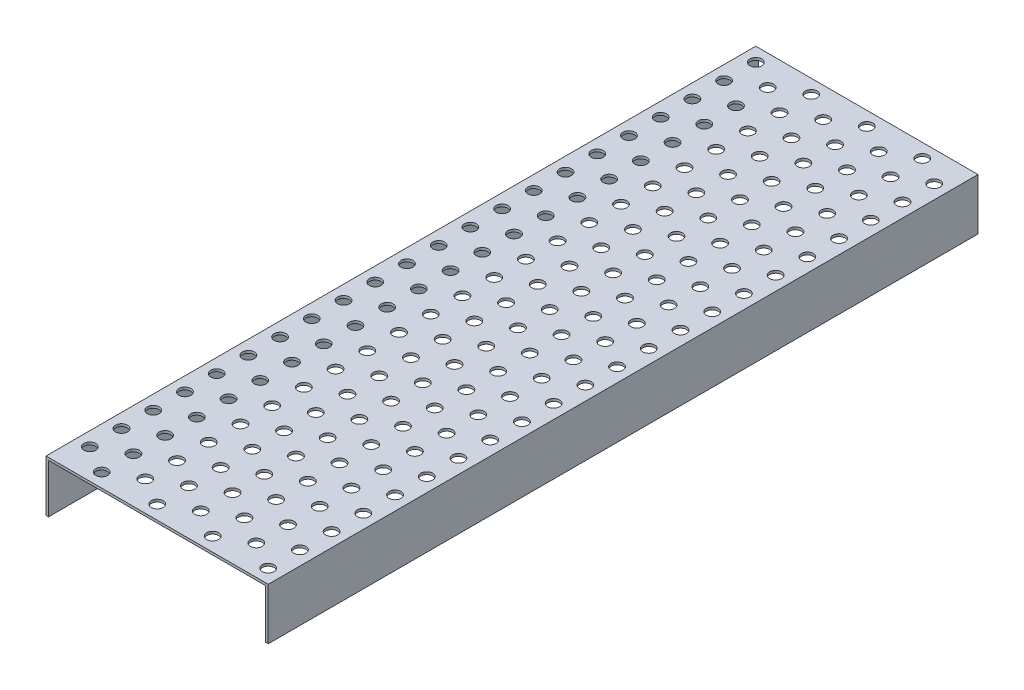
SolidWorks part; units mm, degrees
ref_plane "Alzado" through (0, 0, 0) normal (0, 0, 1) x (1, 0, 0)
ref_plane "Planta" through (0, 0, 0) normal (0, 1, 0) x (1, 0, 0)
ref_plane "Vista lateral" through (0, 0, 0) normal (1, 0, 0) x (0, 0, -1)
sketch "Croquis2" plane through (0, 0, 0) normal (0, 0, 1) x (1, 0, 0)
  line L0 (0, 0) -> (0, 41.275)
  line L1 (0, 41.275) -> (178, 41.275)
  line L2 (0, 0) -> (2, 0)
  line L3 (2, 0) -> (2, 39.275)
  line L4 (178, 41.275) -> (178, 0)
  line L5 (178, 0) -> (176, 0)
  line L6 (176, 0) -> (176, 39.275)
  line L7 (2, 39.275) -> (176, 39.275)
  dimension "D1" = 41.275
  dimension "D2" = 178
  dimension "D3" = 2
  dimension "D4" = 2
  dimension "D5" = 39.275
  dimension "D6" = 39.275
extrude "Saliente-Extruir1" add sketch "Croquis2" along normal blind 568.452
sketch "Croquis3" plane through (0, 41.275, 0) normal (0, 1, 0) x (1, 0, 0)
  circle A0 centre (11.2125, -11.176) radius 4.7625
  circle A1 centre (55.6625, -11.176) radius 4.7625
  circle A2 centre (100.1125, -11.176) radius 4.7625
  circle A3 centre (144.5625, -11.176) radius 4.7625
  circle A4 centre (11.2125, -36.576) radius 4.7625
  circle A5 centre (55.6625, -36.576) radius 4.7625
  circle A6 centre (100.1125, -36.576) radius 4.7625
  circle A7 centre (144.5625, -36.576) radius 4.7625
  circle A8 centre (11.2125, -61.976) radius 4.7625
  circle A9 centre (55.6625, -61.976) radius 4.7625
  circle A10 centre (100.1125, -61.976) radius 4.7625
  circle A11 centre (144.5625, -61.976) radius 4.7625
  circle A12 centre (11.2125, -87.376) radius 4.7625
  circle A13 centre (55.6625, -87.376) radius 4.7625
  circle A14 centre (100.1125, -87.376) radius 4.7625
  circle A15 centre (144.5625, -87.376) radius 4.7625
  circle A16 centre (11.2125, -112.776) radius 4.7625
  circle A17 centre (55.6625, -112.776) radius 4.7625
  circle A18 centre (100.1125, -112.776) radius 4.7625
  circle A19 centre (144.5625, -112.776) radius 4.7625
  circle A20 centre (11.2125, -138.176) radius 4.7625
  circle A21 centre (55.6625, -138.176) radius 4.7625
  circle A22 centre (100.1125, -138.176) radius 4.7625
  circle A23 centre (144.5625, -138.176) radius 4.7625
  circle A24 centre (11.2125, -163.576) radius 4.7625
  circle A25 centre (55.6625, -163.576) radius 4.7625
  circle A26 centre (100.1125, -163.576) radius 4.7625
  circle A27 centre (144.5625, -163.576) radius 4.7625
  circle A28 centre (11.2125, -188.976) radius 4.7625
  circle A29 centre (55.6625, -188.976) radius 4.7625
  circle A30 centre (100.1125, -188.976) radius 4.7625
  circle A31 centre (144.5625, -188.976) radius 4.7625
  circle A32 centre (11.2125, -214.376) radius 4.7625
  circle A33 centre (55.6625, -214.376) radius 4.7625
  circle A34 centre (100.1125, -214.376) radius 4.7625
  circle A35 centre (144.5625, -214.376) radius 4.7625
  circle A36 centre (11.2125, -239.776) radius 4.7625
  circle A37 centre (55.6625, -239.776) radius 4.7625
  circle A38 centre (100.1125, -239.776) radius 4.7625
  circle A39 centre (144.5625, -239.776) radius 4.7625
  circle A40 centre (11.2125, -265.176) radius 4.7625
  circle A41 centre (55.6625, -265.176) radius 4.7625
  circle A42 centre (100.1125, -265.176) radius 4.7625
  circle A43 centre (144.5625, -265.176) radius 4.7625
  circle A44 centre (11.2125, -290.576) radius 4.7625
  circle A45 centre (55.6625, -290.576) radius 4.7625
  circle A46 centre (100.1125, -290.576) radius 4.7625
  circle A47 centre (144.5625, -290.576) radius 4.7625
  circle A48 centre (11.2125, -315.976) radius 4.7625
  circle A49 centre (55.6625, -315.976) radius 4.7625
  circle A50 centre (100.1125, -315.976) radius 4.7625
  circle A51 centre (144.5625, -315.976) radius 4.7625
  circle A52 centre (11.2125, -341.376) radius 4.7625
  circle A53 centre (55.6625, -341.376) radius 4.7625
  circle A54 centre (100.1125, -341.376) radius 4.7625
  circle A55 centre (144.5625, -341.376) radius 4.7625
  circle A56 centre (11.2125, -366.776) radius 4.7625
  circle A57 centre (55.6625, -366.776) radius 4.7625
  circle A58 centre (100.1125, -366.776) radius 4.7625
  circle A59 centre (144.5625, -366.776) radius 4.7625
  circle A60 centre (11.2125, -392.176) radius 4.7625
  circle A61 centre (55.6625, -392.176) radius 4.7625
  circle A62 centre (100.1125, -392.176) radius 4.7625
  circle A63 centre (144.5625, -392.176) radius 4.7625
  circle A64 centre (11.2125, -417.576) radius 4.7625
  circle A65 centre (55.6625, -417.576) radius 4.7625
  circle A66 centre (100.1125, -417.576) radius 4.7625
  circle A67 centre (144.5625, -417.576) radius 4.7625
  circle A68 centre (11.2125, -442.976) radius 4.7625
  circle A69 centre (55.6625, -442.976) radius 4.7625
  circle A70 centre (100.1125, -442.976) radius 4.7625
  circle A71 centre (144.5625, -442.976) radius 4.7625
  circle A72 centre (11.2125, -468.376) radius 4.7625
  circle A73 centre (55.6625, -468.376) radius 4.7625
  circle A74 centre (100.1125, -468.376) radius 4.7625
  circle A75 centre (144.5625, -468.376) radius 4.7625
  circle A76 centre (11.2125, -493.776) radius 4.7625
  circle A77 centre (55.6625, -493.776) radius 4.7625
  circle A78 centre (100.1125, -493.776) radius 4.7625
  circle A79 centre (144.5625, -493.776) radius 4.7625
  circle A80 centre (11.2125, -519.176) radius 4.7625
  circle A81 centre (55.6625, -519.176) radius 4.7625
  circle A82 centre (100.1125, -519.176) radius 4.7625
  circle A83 centre (144.5625, -519.176) radius 4.7625
  circle A84 centre (11.2125, -544.576) radius 4.7625
  circle A85 centre (55.6625, -544.576) radius 4.7625
  circle A86 centre (100.1125, -544.576) radius 4.7625
  circle A87 centre (144.5625, -544.576) radius 4.7625
  circle A88 centre (33.4375, -23.876) radius 4.7625
  circle A89 centre (77.8875, -23.876) radius 4.7625
  circle A90 centre (122.3375, -23.876) radius 4.7625
  circle A91 centre (166.7875, -23.876) radius 4.7625
  circle A92 centre (33.4375, -49.276) radius 4.7625
  circle A93 centre (77.8875, -49.276) radius 4.7625
  circle A94 centre (122.3375, -49.276) radius 4.7625
  circle A95 centre (166.7875, -49.276) radius 4.7625
  circle A96 centre (33.4375, -74.676) radius 4.7625
  circle A97 centre (77.8875, -74.676) radius 4.7625
  circle A98 centre (122.3375, -74.676) radius 4.7625
  circle A99 centre (166.7875, -74.676) radius 4.7625
  circle A100 centre (33.4375, -100.076) radius 4.7625
  circle A101 centre (77.8875, -100.076) radius 4.7625
  circle A102 centre (122.3375, -100.076) radius 4.7625
  circle A103 centre (166.7875, -100.076) radius 4.7625
  circle A104 centre (33.4375, -125.476) radius 4.7625
  circle A105 centre (77.8875, -125.476) radius 4.7625
  circle A106 centre (122.3375, -125.476) radius 4.7625
  circle A107 centre (166.7875, -125.476) radius 4.7625
  circle A108 centre (33.4375, -150.876) radius 4.7625
  circle A109 centre (77.8875, -150.876) radius 4.7625
  circle A110 centre (122.3375, -150.876) radius 4.7625
  circle A111 centre (166.7875, -150.876) radius 4.7625
  circle A112 centre (33.4375, -176.276) radius 4.7625
  circle A113 centre (77.8875, -176.276) radius 4.7625
  circle A114 centre (122.3375, -176.276) radius 4.7625
  circle A115 centre (166.7875, -176.276) radius 4.7625
  circle A116 centre (33.4375, -201.676) radius 4.7625
  circle A117 centre (77.8875, -201.676) radius 4.7625
  circle A118 centre (122.3375, -201.676) radius 4.7625
  circle A119 centre (166.7875, -201.676) radius 4.7625
  circle A120 centre (33.4375, -227.076) radius 4.7625
  circle A121 centre (77.8875, -227.076) radius 4.7625
  circle A122 centre (122.3375, -227.076) radius 4.7625
  circle A123 centre (166.7875, -227.076) radius 4.7625
  circle A124 centre (33.4375, -252.476) radius 4.7625
  circle A125 centre (77.8875, -252.476) radius 4.7625
  circle A126 centre (122.3375, -252.476) radius 4.7625
  circle A127 centre (166.7875, -252.476) radius 4.7625
  circle A128 centre (33.4375, -277.876) radius 4.7625
  circle A129 centre (77.8875, -277.876) radius 4.7625
  circle A130 centre (122.3375, -277.876) radius 4.7625
  circle A131 centre (166.7875, -277.876) radius 4.7625
  circle A132 centre (33.4375, -303.276) radius 4.7625
  circle A133 centre (77.8875, -303.276) radius 4.7625
  circle A134 centre (122.3375, -303.276) radius 4.7625
  circle A135 centre (166.7875, -303.276) radius 4.7625
  circle A136 centre (33.4375, -328.676) radius 4.7625
  circle A137 centre (77.8875, -328.676) radius 4.7625
  circle A138 centre (122.3375, -328.676) radius 4.7625
  circle A139 centre (166.7875, -328.676) radius 4.7625
  circle A140 centre (33.4375, -354.076) radius 4.7625
  circle A141 centre (77.8875, -354.076) radius 4.7625
  circle A142 centre (122.3375, -354.076) radius 4.7625
  circle A143 centre (166.7875, -354.076) radius 4.7625
  circle A144 centre (33.4375, -379.476) radius 4.7625
  circle A145 centre (77.8875, -379.476) radius 4.7625
  circle A146 centre (122.3375, -379.476) radius 4.7625
  circle A147 centre (166.7875, -379.476) radius 4.7625
  circle A148 centre (33.4375, -404.876) radius 4.7625
  circle A149 centre (77.8875, -404.876) radius 4.7625
  circle A150 centre (122.3375, -404.876) radius 4.7625
  circle A151 centre (166.7875, -404.876) radius 4.7625
  circle A152 centre (33.4375, -430.276) radius 4.7625
  circle A153 centre (77.8875, -430.276) radius 4.7625
  circle A154 centre (122.3375, -430.276) radius 4.7625
  circle A155 centre (166.7875, -430.276) radius 4.7625
  circle A156 centre (33.4375, -455.676) radius 4.7625
  circle A157 centre (77.8875, -455.676) radius 4.7625
  circle A158 centre (122.3375, -455.676) radius 4.7625
  circle A159 centre (166.7875, -455.676) radius 4.7625
  circle A160 centre (33.4375, -481.076) radius 4.7625
  circle A161 centre (77.8875, -481.076) radius 4.7625
  circle A162 centre (122.3375, -481.076) radius 4.7625
  circle A163 centre (166.7875, -481.076) radius 4.7625
  circle A164 centre (33.4375, -506.476) radius 4.7625
  circle A165 centre (77.8875, -506.476) radius 4.7625
  circle A166 centre (122.3375, -506.476) radius 4.7625
  circle A167 centre (166.7875, -506.476) radius 4.7625
  circle A168 centre (33.4375, -531.876) radius 4.7625
  circle A169 centre (77.8875, -531.876) radius 4.7625
  circle A170 centre (122.3375, -531.876) radius 4.7625
  circle A171 centre (166.7875, -531.876) radius 4.7625
  circle A172 centre (33.4375, -557.276) radius 4.7625
  circle A173 centre (77.8875, -557.276) radius 4.7625
  circle A174 centre (122.3375, -557.276) radius 4.7625
  circle A175 centre (166.7875, -557.276) radius 4.7625
  dimension "D3" = 9.525
  dimension "D2" = 11.176
  dimension "D5" = 9.525
  dimension "D1" = 11.2125
  dimension "D4" = 12.7
  dimension "D6" = 22.225
  dimension "D7" = 22
  dimension "D8" = 11.176
  dimension "D9" = 22
extrude "Cortar-Extruir1" cut sketch "Croquis3" against normal up to next (2 mm away)
